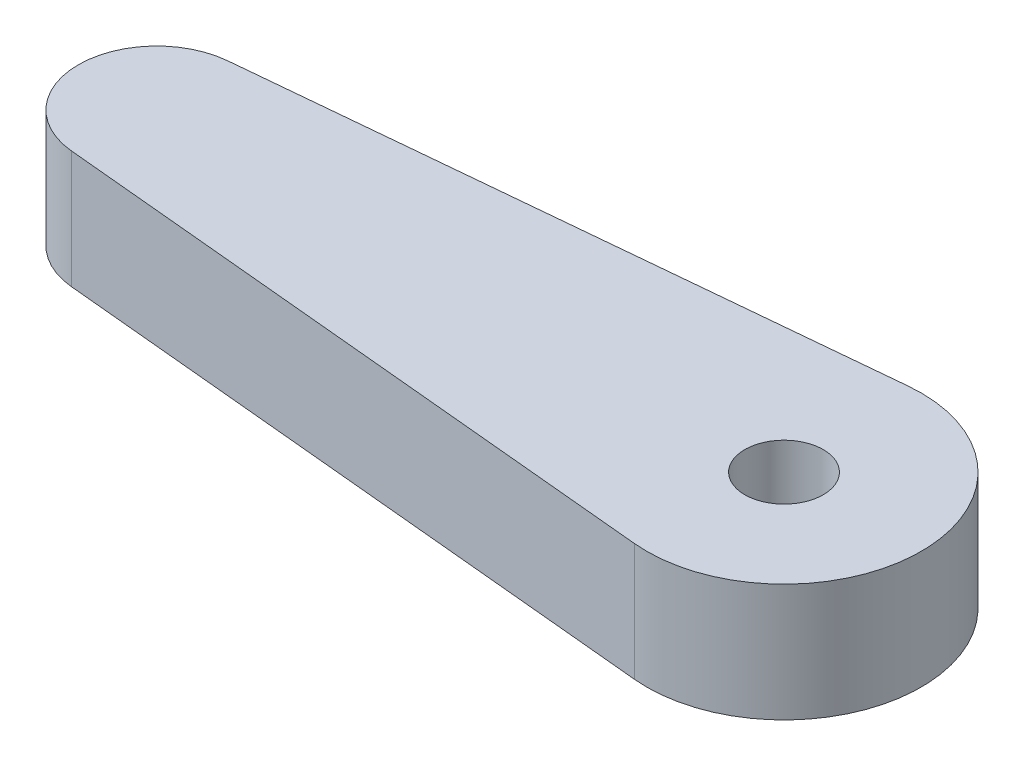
SolidWorks part; units mm, degrees
ref_plane "Front Plane" through (0, 0, 0) normal (0, 0, 1) x (1, 0, 0)
ref_plane "Top Plane" through (0, 0, 0) normal (0, 1, 0) x (1, 0, 0)
ref_plane "Right Plane" through (0, 0, 0) normal (1, 0, 0) x (0, 0, -1)
sketch "Sketch1" plane through (0, 0, 0) normal (0, 1, 0) x (1, 0, 0)
  line L0 (-0.9375, 9.956) -> (78.3594, 17.4229)
  line L1 (-0.9375, -9.956) -> (78.3594, -17.4229)
  arc A0 (-0.9375, 9.956) -> (-0.9375, -9.956) centre (0, 0) ccw
  arc A1 (78.3594, -17.4229) -> (78.3594, 17.4229) centre (80, 0) ccw
  dimension "D1" = 35
  dimension "D2" = 20
extrude "Boss-Extrude1" add sketch "Sketch1" along normal blind 15
sketch "Sketch4" plane through (0, 15, 0) normal (0, 1, 0) x (1, 0, 0)
  circle A0 centre (80, 0) radius 5
extrude "Cut-Extrude1" cut sketch "Sketch4" against normal blind 15
sketch "Sketch5" plane through (0, 0, 0) normal (1, 0, 0) x (0, 0, -1)
  line L0 (0, 0) -> (0, 7.5)
  line L1 (0, 0) -> (7.5, 0)
  line L2 (0, -6.4285) -> (0, 13.5379) construction
  arc A0 (7.5, 0) -> (0, 7.5) centre (0, 0) ccw
  dimension "D1" = 15
revolve "Cut-Revolve3" cut sketch "Sketch5" angle 360 about L2
